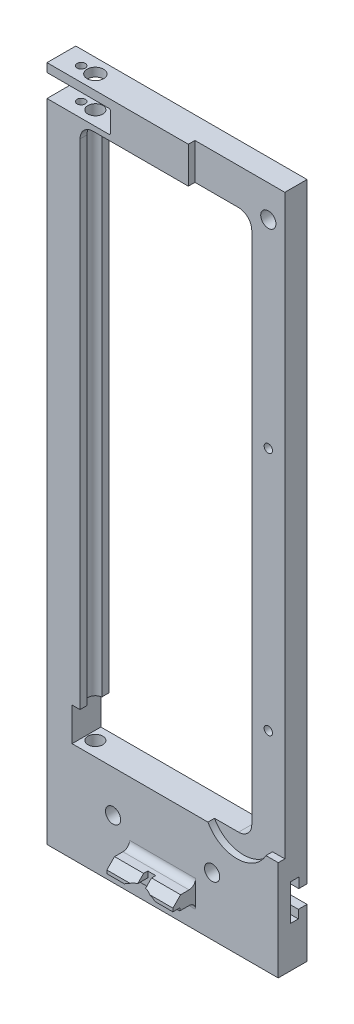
SolidWorks part; units mm, degrees
ref_plane "Front Plane" through (0, 0, 0) normal (0, 0, 1) x (1, 0, 0)
ref_plane "Top Plane" through (0, 0, 0) normal (0, 1, 0) x (1, 0, 0)
ref_plane "Right Plane" through (0, 0, 0) normal (1, 0, 0) x (0, 0, -1)
sketch "Sketch1" plane through (0, 0, 0) normal (0, 0, 1) x (1, 0, 0)
  line L0 (0, 0) -> (0, 158.4614) construction
  line L1 (0, 0) -> (-33.0501, 0) construction
  line L2 (22.225, 130.175) -> (-22.225, 130.175)
  line L3 (0, -155.575) -> (-33.0501, -155.575)
  line L4 (0, 130.175) -> (-33.0501, 130.175) construction
  line L5 (-22.225, 130.175) -> (-22.225, 0)
  line L6 (-22.225, 0) -> (22.225, 0)
  line L7 (22.225, 130.175) -> (22.225, 0)
  line L8 (-15.875, 123.19) -> (-15.875, 25.6386)
  line L9 (15.875, 123.19) -> (15.875, 19.2024)
  line L10 (15.875, 19.2024) -> (-17.399, 19.2024)
  line L11 (-17.399, 19.2024) -> (-17.399, 25.6386)
  line L12 (-17.399, 25.6386) -> (-15.875, 25.6386)
  line L13 (15.875, 130.175) -> (15.875, 0) construction
  line L14 (-15.875, 130.175) -> (-15.875, 0) construction
  line L15 (-15.875, 123.19) -> (15.875, 123.19)
  line L16 (177.8597, 16.3068) -> (191.4486, 16.3068) construction
  line L17 (191.4486, 16.3068) -> (211.7206, 16.3068) construction
  line L18 (211.7206, 16.3068) -> (225.4209, 16.3068) construction
  line L19 (22.225, 0) -> (268.7462, 0) construction
  point P13 (0, 130.175)
  dimension "D1" = 130.175
  dimension "D3" = 44.45
  dimension "D6" = 6.985
  dimension "D7" = 19.2024
  dimension "D8" = 16.3068
  dimension "D9" = 1.524
  dimension "D2" = 155.575
  dimension "D4" = 6.35
  dimension "D5" = 6.35
extrude "Boss-Extrude1" add sketch "Sketch1" along normal mid plane 5.5372 contours L7 L2 L5 L6 L8 L15 L9 L10 L11 L12
sketch "Sketch2" plane through (0, 0, 0) normal (1, 0, 0) x (0, 0, -1)
  line L0 (2.7686, 9.4996) -> (1.104, 9.4996)
  line L1 (2.7686, 130.175) -> (2.7686, 0) construction
  line L2 (1.104, 9.4996) -> (1.104, 7.8994)
  line L3 (1.104, 7.8994) -> (-0.4064, 7.8994)
  line L4 (-0.4064, 7.8994) -> (-0.4064, 14.8336)
  line L5 (-0.4064, 14.8336) -> (1.1811, 14.8336)
  line L6 (1.1811, 14.8336) -> (1.1811, 12.9032)
  line L7 (1.1811, 12.9032) -> (2.7686, 12.9032)
  line L8 (2.7686, 12.9032) -> (2.7686, 9.4996)
  line L10 (-2.7686, 0) -> (2.7686, 0) construction
  point P4 (0.3488, 7.8994)
  dimension "D1" = 1.6002
  dimension "D2" = 1.9304
  dimension "D3" = 3.4036
  dimension "D4" = 1.5875
  dimension "D5" = 3.175
  dimension "D6" = 9.4996
extrude "Cut-Extrude1" cut sketch "Sketch2" against normal through all both and the other way through all
sketch "Sketch3" plane through (0, 0, 2.7686) normal (0, 0, 1) x (1, 0, 0)
  line L0 (-22.225, 12.9032) -> (-22.225, 9.4996) construction
  line L1 (-22.225, 11.2014) -> (22.225, 11.2014) construction
  line L2 (22.225, 130.175) -> (22.225, 0) construction
  line L3 (-22.225, 130.175) -> (-22.225, 0) construction
  line L4 (19.05, 130.175) -> (19.05, 11.2014) construction
  line L5 (22.225, 130.175) -> (-22.225, 130.175) construction
  circle A0 centre (-9.525, 11.2014) radius 1.4605
  circle A1 centre (9.525, 11.2014) radius 1.4605
  circle A2 centre (19.05, 124.0536) radius 1.4605
  circle A3 centre (19.05, 85.9536) radius 0.8001
  circle A4 centre (19.05, 38.9636) radius 0.8001
  dimension "D4" = 1.6002
  dimension "D5" = 2.921
  dimension "D9" = 2.921
  dimension "D1" = 12.7
  dimension "D2" = 19.05
  dimension "D3" = 3.175
  dimension "D6" = 6.1214
  dimension "D7" = 38.1
  dimension "D8" = 46.99
extrude "Cut-Extrude2" cut sketch "Sketch3" against normal up to next
sketch "Sketch4" plane through (0, 0, 2.7686) normal (0, 0, 1) x (1, 0, 0)
  line L0 (22.225, 130.175) -> (-22.225, 130.175) construction
  line L1 (4.953, 130.175) -> (22.225, 130.175)
  line L2 (4.953, 130.175) -> (4.953, 19.2024)
  line L3 (4.953, 19.2024) -> (22.225, 19.2024)
  line L4 (22.225, 130.175) -> (22.225, 19.2024)
  line L5 (22.225, 130.175) -> (22.225, 0) construction
  line L6 (15.875, 19.2024) -> (-17.399, 19.2024) construction
  dimension "D1" = 17.272
extrude "Cut-Extrude3" cut sketch "Sketch4" against normal blind 1.27
sketch "Sketch5" plane through (0, 0, 2.7686) normal (0, 0, 1) x (1, 0, 0)
  line L0 (-22.225, 0) -> (22.225, 0) construction
  line L1 (22.225, 19.2024) -> (22.225, 130.175) construction
  circle A0 centre (14.2875, 22.2352) radius 6.35
  dimension "D1" = 12.7
  dimension "D2" = 22.2352
  dimension "D3" = 7.9375
extrude "Cut-Extrude4" cut sketch "Sketch5" against normal up to surface (1.27 mm away)
sketch "Sketch6" plane through (0, 0, 2.7686) normal (0, 0, 1) x (1, 0, 0)
  line L0 (-22.225, 130.175) -> (-22.225, 0) construction
  line L1 (-22.225, 128.524) -> (-10.033, 128.524)
  line L2 (-22.225, 128.524) -> (-22.225, 124.206)
  line L3 (-22.225, 124.206) -> (-10.033, 124.206)
  line L4 (-10.033, 128.524) -> (-10.033, 124.206)
  line L5 (4.953, 130.175) -> (-22.225, 130.175) construction
  dimension "D1" = 1.651
  dimension "D2" = 4.318
  dimension "D3" = 12.192
extrude "Cut-Extrude5" cut sketch "Sketch6" against normal through all
sketch "Sketch7" plane through (0, 130.175, 0) normal (0, 1, 0) x (1, 0, 0)
  line L0 (-22.225, 0) -> (-15.6972, 0) construction
  line L1 (-22.225, -2.7686) -> (-22.225, 2.7686) construction
  line L2 (22.225, 2.7686) -> (-22.225, 2.7686) construction
  circle A0 centre (-15.6972, 0) radius 1.5875
  circle A1 centre (-19.2532, 0) radius 0.7874 construction
  dimension "D2" = 3.175
  dimension "D5" = 1.5748
  dimension "D1" = 2.7686
  dimension "D3" = 6.5278
  dimension "D4" = 3.556
extrude "Cut-Extrude6" cut sketch "Sketch7" against normal up to next
fillet "Fillet1" radius 0.254 2 edges at (-10.033, 124.206, 0) (-10.033, 128.524, 0)
sketch "Sketch8" plane through (0, 130.175, 0) normal (0, 1, 0) x (1, 0, 0)
  circle A0 centre (-15.6972, 0) radius 1.4351
  dimension "D1" = 2.8702
extrude "Cut-Extrude7" cut sketch "Sketch8" against normal up to surface (115.3414 mm away)
fillet "Fillet2" radius 2.54 3 edges at (-15.875, 123.19, -2.0963) (15.875, 123.19, -0.635) (15.875, 19.2024, -0.635)
chamfer "Chamfer1" distance 0.508 angle 55 2 edges at (19.8501, 38.9636, -2.7686) (19.8501, 85.9536, -2.7686)
sketch "Sketch11" plane through (0, 0, 0) normal (1, 0, 0) x (0, 0, -1)
  line L0 (-2.7686, 4.7498) -> (-5.8166, 4.7498)
  line L1 (-2.7686, 19.2024) -> (-2.7686, 0) construction
  line L2 (-7.1374, 5.2578) -> (-7.1374, 5.8845)
  line L3 (-7.1374, 5.8845) -> (-5.6559, 7.366)
  line L4 (-5.6559, 7.366) -> (-2.7686, 7.366)
  line L5 (-2.7686, 7.366) -> (-2.7686, 4.7498)
  line L6 (2.7686, 9.4996) -> (2.7686, 0) construction
  line L7 (-7.1374, 5.2578) -> (-5.8166, 5.2578)
  line L8 (-5.8166, 5.2578) -> (-5.8166, 4.7498)
  line L9 (-2.7686, 6.0579) -> (-6.964, 6.0579) construction
  line L11 (-2.7686, 0) -> (2.7686, 0) construction
  point P9 (-7.1374, 5.5711)
  point P16 (-5.8166, 5.0038)
  dimension "D1" = 9.906
  dimension "D2" = 2.6162
  dimension "D3" = 0.508
  dimension "D4" = 45
  dimension "D5" = 4.7498
  dimension "D6" = 2.8873
  dimension "D7" = 3.048
extrude "Boss-Extrude2" add sketch "Sketch11" along normal mid plane 12.7
sketch "Sketch12" plane through (0, 0, 7.1374) normal (0, 0, 1) x (1, 0, 0)
  line L0 (0, 4.7498) -> (0, 8.004) construction
  line L1 (6.35, 4.7498) -> (-6.35, 4.7498) construction
  line L2 (0.762, 4.7498) -> (0.762, 8.004)
  line L3 (-0.762, 4.7498) -> (-0.762, 8.004)
  line L4 (-0.762, 4.7498) -> (0.762, 4.7498)
  line L5 (-0.762, 8.004) -> (0.762, 8.004)
  dimension "D1" = 0.762
  dimension "D2" = 0.762
extrude "Cut-Extrude8" cut sketch "Sketch12" against normal blind 2.286
sketch "Sketch13" plane through (0, 0, -2.7686) normal (0, 0, -1) x (-1, 0, 0)
  line L0 (0, 0) -> (0, 4.7498) construction
  circle A0 centre (0, 4.7498) radius 2.4003
  dimension "D2" = 4.8006
  dimension "D1" = 4.7498
extrude "Cut-Extrude9" cut sketch "Sketch13" against normal up to surface (5.5372 mm away)
sketch "Sketch19" plane through (0, 0, 7.1374) normal (0, 0, 1) x (1, 0, 0)
  circle A0 centre (0, 1.524) radius 4.7625
  dimension "D1" = 9.525
  dimension "D2" = 1.524
extrude "Cut-Extrude11" cut sketch "Sketch19" against normal up to surface (2.286 mm away)
fillet "Fillet3" radius 1.27 3 edges at (-4.3751, 4.7498, 2.7686) (4.3751, 4.7498, 2.7686) (0, 7.366, 2.7686)
sketch "Sketch20" plane through (0, 130.175, 0) normal (0, 1, 0) x (1, 0, 0)
  line L0 (-22.225, 0) -> (-15.6972, 0) construction
  line L1 (-22.225, -2.7686) -> (-22.225, 2.7686) construction
  circle A0 centre (-18.4194, 0) radius 0.7874
  dimension "D1" = 1.5748
extrude "Cut-Extrude12" cut sketch "Sketch20" against normal blind 17.272
